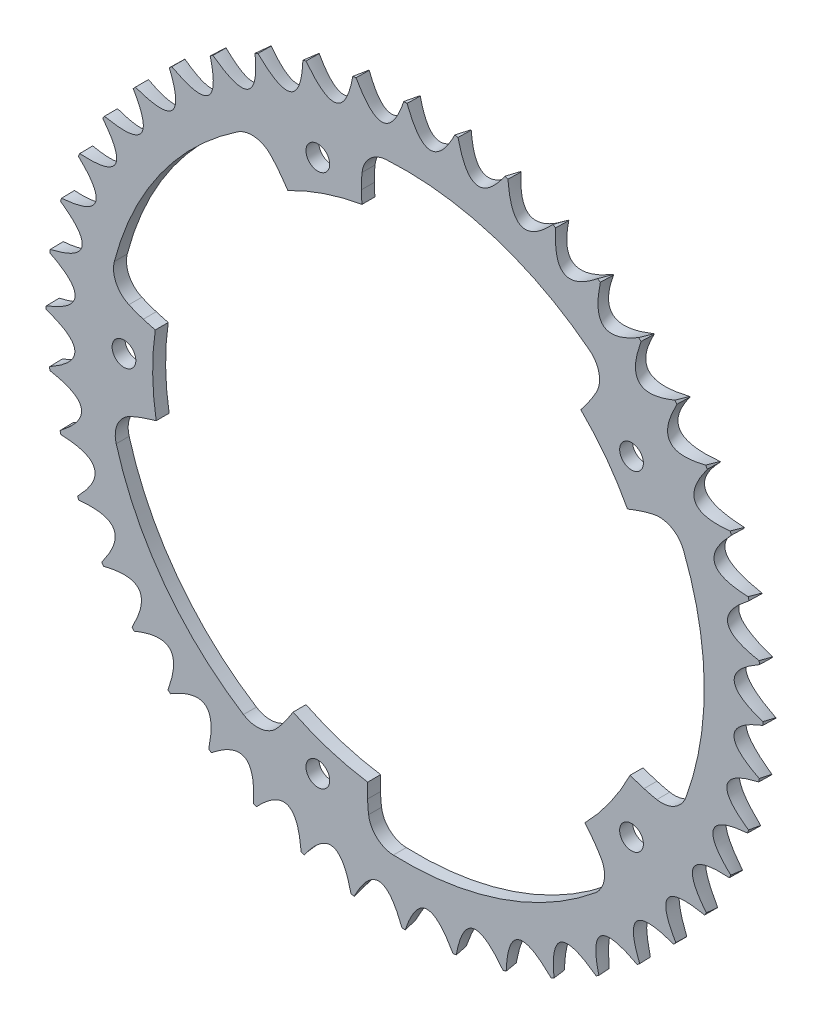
SolidWorks part; units mm, degrees
ref_plane "Front Plane" through (0, 0, 0) normal (0, 0, 1) x (1, 0, 0)
ref_plane "Top Plane" through (0, 0, 0) normal (0, 1, 0) x (1, 0, 0)
ref_plane "Right Plane" through (0, 0, 0) normal (1, 0, 0) x (0, 0, -1)
sketch "Sketch1" plane through (0, 0, 0) normal (0, 0, 1) x (1, 0, 0)
  circle A0 centre (279.748, 369.4504) radius 110
  circle A1 centre (342.4858, 546.15) radius 10.6297
  circle A2 centre (342.4858, 546.15) radius 17.6769
  circle A3 centre (279.748, 369.4504) radius 11.2955
  circle A4 centre (279.748, 369.4504) radius 10.287
  circle A5 centre (279.748, 369.4504) radius 3.9634
  circle A6 centre (279.748, 369.4504) radius 6.6165
  circle A7 centre (279.748, 369.4504) radius 58.3517
  arc A8 (332.056, 343.5893) -> (331.4312, 396.5385) centre (343.5749, 370.2035) ccw
  arc A9 (302.4172, 372.0344) -> (302.5282, 366.6721) centre (306.6918, 369.4405) ccw
  arc A10 (302.4172, 372.0344) -> (334.0919, 397.6093) centre (353.7118, 340.9078) cw
  arc A11 (302.5282, 366.6721) -> (335.2334, 342.4291) centre (352.4915, 399.8935) ccw
  circle A12 centre (279.748, 369.4504) radius 69.4397
  circle A13 centre (279.748, 369.4504) radius 83.0136
  arc A28 (340.6546, 442.4916) -> (334.53, 439.4947) centre (338.401, 439.3405) ccw
  arc A29 (359.6469, 401.9297) -> (364.7567, 406.4443) centre (360.9836, 405.5659) ccw
  arc A30 (364.7567, 406.4443) -> (340.6546, 442.4916) centre (304.9097, 392.5104) ccw
  arc A31 (334.53, 439.4947) -> (359.6469, 401.9297) centre (372.8938, 437.9663) ccw
  arc A32 (335.3278, 303.4987) -> (341.2005, 300.0341) centre (339.1991, 303.3511) ccw
  arc A33 (363.2927, 338.9945) -> (335.3278, 303.4987) centre (373.6942, 302.036) ccw
  arc A34 (341.2005, 300.0341) -> (368.0356, 334.0958) centre (309.4548, 352.6462) ccw
  arc A35 (368.0356, 334.0958) -> (363.2927, 338.9945) centre (364.3423, 335.2653) ccw
  arc A36 (289.2108, 348.6892) -> (284.1452, 346.9266) centre (288.0648, 343.8223) ccw
  arc A37 (289.2108, 348.6892) -> (323.3219, 326.4678) centre (275.4585, 290.2865) cw
  arc A38 (284.1452, 346.9266) -> (271.1952, 308.3306) centre (331.1802, 309.6746) ccw
  arc A39 (271.3168, 311.711) -> (321.4814, 328.6675) centre (300.1879, 308.9802) ccw
  arc A40 (234.1994, 296.2107) -> (232.7191, 289.5548) centre (235.2553, 292.4833) ccw
  arc A41 (276.5995, 280.5833) -> (234.1994, 296.2107) centre (244.6642, 259.2701) ccw
  arc A42 (232.7191, 289.5548) -> (273.4062, 274.5588) centre (272.9462, 336.0048) ccw
  arc A43 (273.4062, 274.5588) -> (276.5995, 280.5833) centre (273.3772, 278.4327) ccw
  arc A44 (262.9272, 354.0352) -> (259.6855, 358.3082) centre (257.9443, 353.6212) ccw
  arc A45 (262.9272, 354.0352) -> (252.3343, 314.7268) centre (203.1332, 349.067) cw
  arc A46 (259.6855, 358.3082) -> (218.9767, 358.6975) centre (238.7913, 302.0638) ccw
  arc A47 (222.2293, 359.6265) -> (253.8575, 317.157) centre (228.5538, 331.3246) ccw
  arc A48 (196.0176, 390.1374) -> (189.2301, 389.4884) centre (192.799, 387.9814) ccw
  arc A49 (194.2575, 344.9833) -> (196.0176, 390.1374) centre (164.1189, 368.7695) ccw
  arc A50 (189.2301, 389.4884) -> (187.541, 346.1587) centre (245.8375, 365.584) ccw
  arc A51 (187.541, 346.1587) -> (194.2575, 344.9833) centre (191.2164, 347.3834) ccw
  arc A52 (259.8894, 380.6844) -> (262.9516, 385.0879) centre (257.9559, 385.2954) ccw
  arc A53 (259.8894, 380.6844) -> (219.2315, 378.6119) centre (236.687, 436.0166) cw
  arc A54 (262.9516, 385.0879) -> (250.7421, 423.9245) centre (203.0033, 387.5789) ccw
  arc A55 (252.6307, 421.1182) -> (222.0135, 377.9142) centre (227.6683, 406.3575) ccw
  arc A56 (273.5485, 455.4754) -> (270.8338, 461.7302) centre (270.5033, 457.8702) ccw
  arc A57 (230.0605, 443.196) -> (273.5485, 455.4754) centre (243.3691, 479.2099) ccw
  arc A58 (270.8338, 461.7302) -> (229.1028, 449.9469) centre (265.592, 400.5064) ccw
  arc A59 (229.1028, 449.9469) -> (230.0605, 443.196) centre (231.4033, 446.8299) ccw
  arc A60 (284.2956, 391.8086) -> (289.4298, 390.257) centre (288.0835, 395.0723) ccw
  arc A61 (284.2956, 391.8086) -> (269.7605, 429.836) centre (329.7497, 430.9739) cw
  arc A62 (289.4298, 390.257) -> (322.5927, 413.8701) centre (273.2739, 448.041) ccw
  arc A63 (320.5074, 411.2067) -> (269.9566, 426.9746) centre (298.7553, 430.386) ccw
  dimension "D1" = 220
  dimension "D2" = 29
  dimension "D3" = 5
extrude "Extrude1" add sketch "Sketch1" along normal blind 3 contours A12 A55 A13 | A63 A13 A57 A55 A12 | A13 A57 | A13 A63 A12 | A63 A12 A8 A13 A31 | A13 A31 | A63 A12 A55 A54 A7 A61 | A63 A62 A7 A10 A8 A12 | A39 A12 A8 A11 A7 A37 | A39 A13 A33 A8 A12 | A13 A33 | A8 A13 A12 | A12 A39 A13 | A47 A12 A39 A38 A7 A45 | A47 A13 A41 A39 A12 | A13 A41 | A12 A47 A13 | A55 A13 A49 A47 A12 | A13 A49 | A55 A12 A47 A46 A7 A53
hole_wizard "M5 Clearance Hole1" positions "Sketch4" profile "Sketch3" hole size "M5" standard "ISO"
sketch "Sketch4" plane through (0, 0, 3) normal (0, 0, 1) x (1, 0, 0)
  line L0 (279.748, 369.4504) -> (354.8548, 424.0186) construction
  circle A0 centre (279.748, 369.4504) radius 65 construction
  point P0 (332.3341, 407.6564)
  dimension "D1" = 130
sketch "Sketch3" plane through (332.3341, 407.6564, 3) normal (1, 0, 0) x (0, -1, 0)
  line L0 (0, 0) -> (0, 11.6524)
  line L1 (0, 11.6524) -> (2.75, 10)
  line L2 (2.75, 10) -> (2.75, 0)
  line L5 (2.75, 0) -> (0, 0)
  line L10 (0, 11.6524) -> (-2.75, 10) construction
  line L11 (0, -6.35) -> (0, 107.95) construction
  dimension "Hole Dia." = 5.5
  dimension "Hole Depth" = 10
  dimension "Drill Angle" = 118
ref_axis "Axis1" through (279.748, 369.4504, 3) along (0, 0, -1)
pattern_circular "CirPattern1" count 5 over 360 about axis through (279.748, 369.4504, 0) along (0, 0, 1) of "M5 Clearance Hole1"
sketch "Sketch5" plane through (0, 0, 3) normal (0, 0, 1) x (1, 0, 0)
  line L0 (279.748, 369.4504) -> (279.748, 461.3546) construction
  arc A1 (279.748, 454.0649) -> (292.1123, 453.1644) centre (284.6757, 436.3904) cw
  spline S0 degree 2 poles (279.748, 454.0649) (285.2317, 437.9466) (292.1123, 453.1644) knots 0 0 0 1 1 1
sketch "Sketch6" plane through (0, 0, 0) normal (0, 0, -1) x (-1, 0, 0)
  arc A1 (-280.084, 453.9603) -> (-292.9221, 452.7646) centre (-284.91, 436.2578) ccw
  parabola Q1
loft "Cut-Loft1" cut profiles "Sketch6", "Sketch5"
pattern_circular "CirPattern2" count 44 over 360 about axis through (279.748, 369.4504, 3) along (0, 0, -1) of "Cut-Loft1"
fillet "Fillet1" radius 6 10 edges at (343.1841, 341.2062, 1.5) (342.5, 399.1836, 1.5) (272.4891, 300.3911, 1.5) (327.4175, 318.9578, 1.5) (211.8257, 355.0136, 1.5) (246.4574, 308.511, 1.5) (211.5039, 382.2803, 1.5) (245.0287, 429.5872, 1.5) (326.2127, 421.0537, 1.5) (270.8614, 438.3191, 1.5)
